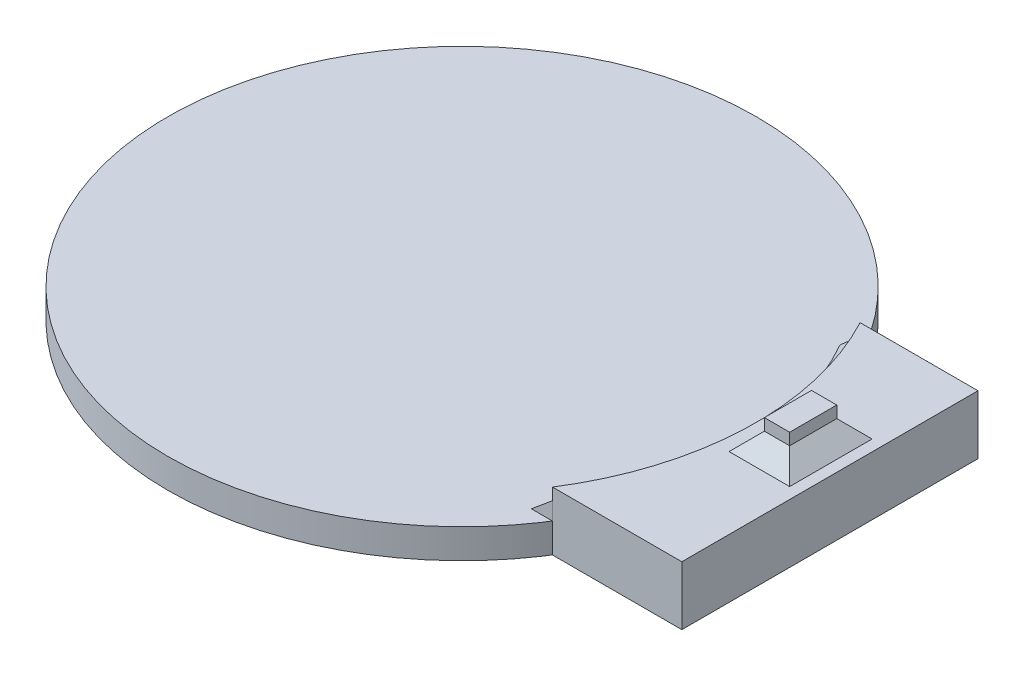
SolidWorks part; units mm, degrees
other "Detailelement1"
other "Detailelement4"
ref_plane "XZ (Vo, Hi)" through (0, 0, 0) normal (0, 0, 1) x (1, 0, 0)
ref_plane "XY (Ob, Un)" through (0, 0, 0) normal (0, 1, 0) x (1, 0, 0)
ref_plane "YZ (Li, Re)" through (0, 0, 0) normal (1, 0, 0) x (0, 0, -1)
sketch "Skizze1" plane through (0, 0, 0) normal (0, 1, 0) x (1, 0, 0)
  circle A0 centre (0, 0) radius 50
  dimension "D1" = 100
extrude "Linear austragen1" add sketch "Skizze1" along normal blind 5
sketch "Skizze2" plane through (0, 0, 0) normal (0, 1, 0) x (1, 0, 0)
  line L0 (64.1693, 23.5001) -> (44.1332, 23.5001)
  line L1 (64.1693, 23.5001) -> (64.1693, -26.8267)
  line L2 (64.1693, -26.8267) -> (42.194, -26.8267)
  circle A0 centre (0, 0) radius 50 construction
  arc A1 (42.194, -26.8267) -> (44.1332, 23.5001) centre (0, 0) ccw
extrude "Linear austragen2" add sketch "Skizze2" along normal blind 10 separate body
sketch "Skizze3" plane through (0, 10, 0) normal (0, 1, 0) x (-1, 0, 0)
  line L1 (-54.9713, 3.6036) -> (-59.2701, 3.6036)
  line L2 (-54.9713, 3.6036) -> (-54.9713, -4.4021)
  line L3 (-54.9713, -4.4021) -> (-59.2701, -4.4021)
  line L4 (-59.2701, 3.6036) -> (-59.2701, -4.4021)
extrude "Linear austragen3" add sketch "Skizze3" along normal blind 5 separate body
other "Kehlnaht1" parameters "D10"=6, "D11"=3, "D12"=0, "D13"=3, "D14"=0
other "Kehlnaht4" parameters "D10"=6, "D11"=3, "D12"=0, "D13"=3, "D14"=0
